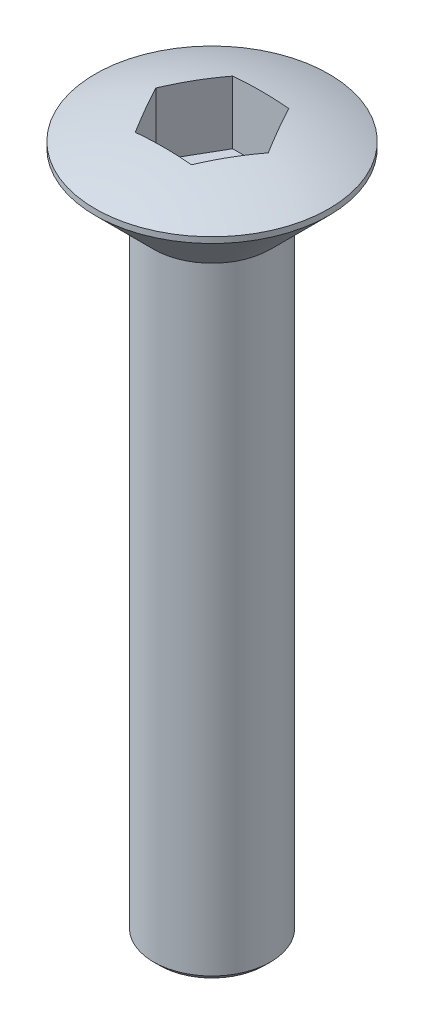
SolidWorks part; units mm, degrees
ref_plane "Plan de face" through (0, 0, 0) normal (0, 0, 1) x (1, 0, 0)
ref_plane "Plan de dessus" through (0, 0, 0) normal (0, 1, 0) x (1, 0, 0)
ref_plane "Plan de droite" through (0, 0, 0) normal (1, 0, 0) x (0, 0, -1)
sketch "Esquisse1" plane through (0, 0, 0) normal (0, 0, 1) x (1, 0, 0)
  line L0 (0, -35) -> (0, 1.5)
  line L1 (0, -55) -> (0, 55) construction
  line L2 (0, -35) -> (2.7, -35)
  line L3 (2.7, -35) -> (3, -34.7)
  line L4 (3, -34.7) -> (3, -3)
  line L5 (3, -3) -> (6, 0)
  line L6 (6, 0) -> (6, 0.3)
  line L7 (0, 1.5) -> (-3.2234, 1.5) construction
  line L9 (55, 0) -> (-55, 0) construction
  arc A0 (0, 1.5) -> (6, 0.3) centre (0, -14.1) cw
revolve "Révolution2" add sketch "Esquisse1" angle 360 about L0
sketch "Esquisse2" plane through (0, 0, 0) normal (0, 1, 0) x (1, 0, 0)
  line L0 (-55, 0) -> (55, 0) construction
  line L1 (-1.4434, -2.5) -> (1.4434, -2.5)
  line L2 (1.4434, -2.5) -> (2.8868, 0)
  line L3 (2.8868, 0) -> (1.4434, 2.5)
  line L4 (1.4434, 2.5) -> (-1.4434, 2.5)
  line L5 (-1.4434, 2.5) -> (-2.8868, 0)
  line L6 (-2.8868, 0) -> (-1.4434, -2.5)
  circle A2 centre (0, 0) radius 2.5 construction
  dimension "D1" = 5
extrude "Enlèv. mat.-Extru.1" cut sketch "Esquisse2" against normal blind 2 and the other way through all
equation "\"D4@Esquisse1\"=\"D2@Esquisse1\"/10"
equation "\"D7@Esquisse1\"=\"D4@Esquisse1\""
equation "\"D8@Esquisse1\"=\"D2@Esquisse1\"/2"
